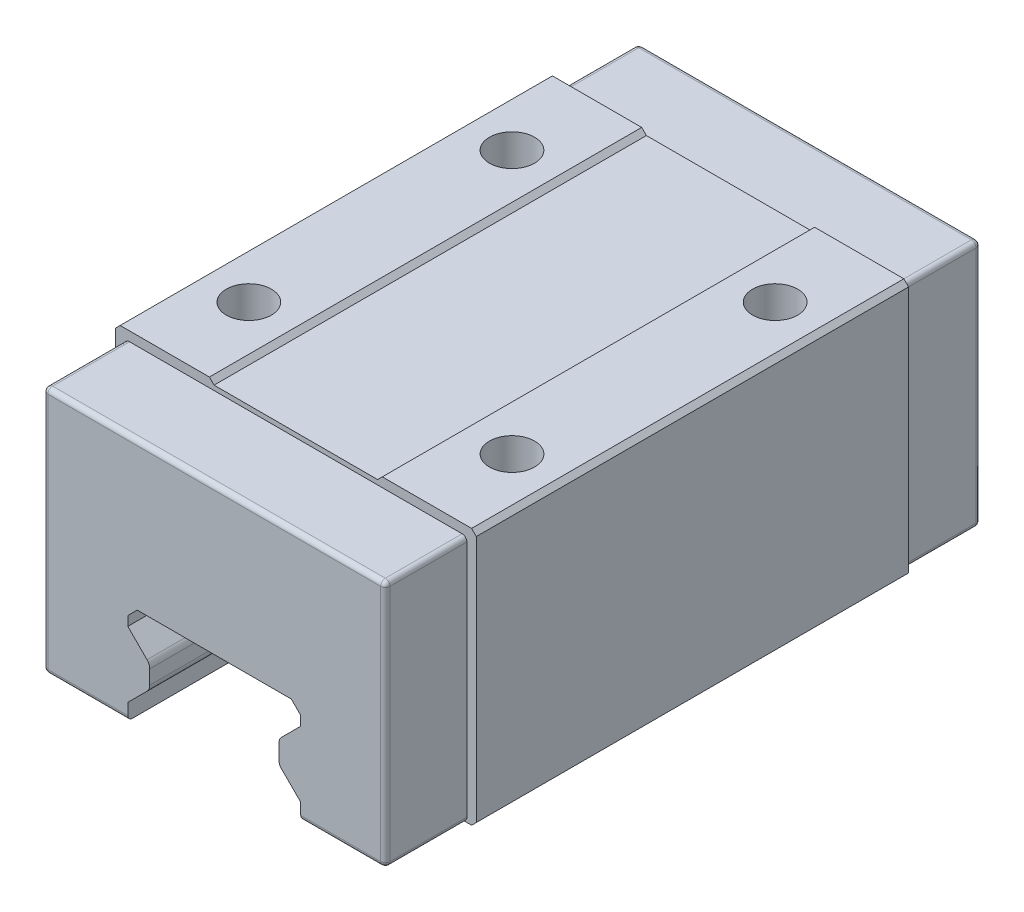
SolidWorks part; units mm, degrees
ref_plane "Front Plane" through (0, 0, 0) normal (0, 0, 1) x (1, 0, 0)
ref_plane "Top Plane" through (0, 0, 0) normal (0, 1, 0) x (1, 0, 0)
ref_plane "Right Plane" through (0, 0, 0) normal (1, 0, 0) x (0, 0, -1)
sketch "Sketch1" plane through (0, 0, 0) normal (0, 0, 1) x (1, 0, 0)
  line L1 (-24, 5.8) -> (24, 5.8)
  line L2 (-24, 5.8) -> (-24, 40)
  line L3 (-24, 40) -> (24, 40)
  line L4 (24, 5.8) -> (24, 40)
  line L5 (-24, 5.8) -> (24, 40) construction
  line L6 (-24, 40) -> (24, 5.8) construction
  point P0 (0, 22.9)
  dimension "D1" = 40
  dimension "D2" = 5.8
  dimension "D3" = 48
extrude "Boss-Extrude1" add sketch "Sketch1" along normal mid plane 57.5
sketch "Sketch2" plane through (0, 0, 0) normal (0, 0, 1) x (1, 0, 0)
  line L0 (-24, 5.8) -> (24, 5.8) construction
  line L1 (-22.75, 5.8) -> (22.75, 5.8)
  line L2 (-22.75, 5.8) -> (-22.75, 38.75)
  line L3 (-22.75, 38.75) -> (22.75, 38.75)
  line L4 (22.75, 5.8) -> (22.75, 38.75)
  line L5 (-22.75, 38.75) -> (-24, 38.75) construction
  line L6 (-24, 40) -> (-24, 5.8) construction
  line L7 (22.75, 38.75) -> (22.75, 40) construction
  line L8 (24, 40) -> (-24, 40) construction
  line L9 (22.75, 38.75) -> (24, 38.75) construction
  line L10 (24, 5.8) -> (24, 40) construction
  point P9 (0, 38.75)
  dimension "D1" = 1.25
extrude "Boss-Extrude2" add sketch "Sketch2" along normal mid plane 79.2
sketch "Sketch3" plane through (0, 0, 39.6) normal (0, 0, 1) x (1, 0, 0)
  line L1 (-11.5, 19.2) -> (11.5, 19.2)
  line L2 (-11.5, 19.2) -> (-11.5, 0)
  line L3 (-11.5, 0) -> (11.5, 0)
  line L4 (11.5, 19.2) -> (11.5, 0)
  line L5 (-11.5, 19.2) -> (11.5, 0) construction
  line L6 (-11.5, 0) -> (11.5, 19.2) construction
  point P0 (0, 9.6)
  dimension "D1" = 23
  dimension "D2" = 19.2
extrude "Cut-Extrude1" cut sketch "Sketch3" against normal through all
sketch "Sketch4" plane through (0, 0, 39.6) normal (0, 0, 1) x (1, 0, 0)
  line L0 (-11.5, 16.7) -> (-11.5, 7.95)
  line L1 (-11.5, 19.2) -> (-11.5, 5.8) construction
  line L2 (-11.5, 7.95) -> (-8.5833, 10.8667)
  line L3 (-8.5833, 10.8667) -> (-8.5833, 13.7833)
  line L4 (-8.5833, 13.7833) -> (-11.5, 16.7)
  line L5 (11.5, 19.2) -> (-11.5, 19.2) construction
  line L6 (-8.5833, 13.7833) -> (-11.5, 13.7833) construction
  line L7 (-8.5833, 10.8667) -> (-11.5, 10.8667) construction
  line L8 (-10.0417, 13.7833) -> (-10.0417, 10.8667) construction
  line L9 (0, 0) -> (0, 19.2) construction
  line L10 (10.0417, 13.7833) -> (10.0417, 10.8667) construction
  line L11 (8.5833, 10.8667) -> (11.5, 10.8667) construction
  line L12 (8.5833, 13.7833) -> (11.5, 13.7833) construction
  line L13 (8.5833, 13.7833) -> (11.5, 16.7)
  line L14 (8.5833, 10.8667) -> (8.5833, 13.7833)
  line L15 (11.5, 7.95) -> (8.5833, 10.8667)
  line L16 (11.5, 16.7) -> (11.5, 7.95)
extrude "Boss-Extrude3" add sketch "Sketch4" against normal up to surface (79.2 mm away)
chamfer "Chamfer1" distance 1.25 angle 45 2 edges at (11.5, 19.2, 0) (-11.5, 19.2, 0)
fillet "Fillet1" radius 1.25 4 edges at (8.5833, 10.8667, 0) (8.5833, 13.7833, 0) (-8.5833, 10.8667, 0) (-8.5833, 13.7833, 0)
sketch "Sketch5" plane through (0, 0, 28.75) normal (0, 0, 1) x (1, 0, 0)
  line L0 (24, 40) -> (-24, 40) construction
  line L1 (-11.5, 40) -> (11.5, 40)
  line L2 (-11.5, 40) -> (-11.5, 39.375)
  line L3 (-11.5, 39.375) -> (11.5, 39.375)
  line L4 (11.5, 40) -> (11.5, 39.375)
  point P6 (0, 39.375)
  dimension "D1" = 23
  dimension "D2" = 0.625
extrude "Cut-Extrude2" cut sketch "Sketch5" against normal through all
chamfer "Chamfer2" distance 0.625 angle 45 6 edges at (24, 40, 0) (24, 5.8, 0) (-24, 5.8, 0) (-24, 40, 0) (11.5, 39.375, 0) (-11.5, 39.375, 0)
fillet "Fillet2" radius 0.625 18 edges at (-22.75, 5.8, -34.175) (17.125, 5.8, -39.6) (-22.75, 5.8, 34.175) (-17.125, 5.8, -39.6) (-17.125, 5.8, 39.6) (17.125, 5.8, 39.6) (22.75, 5.8, 34.175) (-22.75, 22.275, 39.6) (-22.75, 22.275, -39.6) (-22.75, 38.75, 34.175) (22.75, 38.75, 34.175) (22.75, 22.275, 39.6) (22.75, 22.275, -39.6) (0, 38.75, 39.6) (0, 38.75, -39.6) (22.75, 5.8, -34.175) (22.75, 38.75, -34.175) (-22.75, 38.75, -34.175)
sketch "Sketch6" plane through (0, 40, 0) normal (0, 1, 0) x (1, 0, 0)
  line L0 (-17.5, 17.5) -> (0, 0) construction
  line L1 (0, 0) -> (17.5, -17.5) construction
  line L2 (17.5, 17.5) -> (0, 0) construction
  line L3 (0, 0) -> (-17.5, -17.5) construction
  circle A0 centre (-17.5, 17.5) radius 3
  circle A1 centre (-17.5, -17.5) radius 3
  circle A2 centre (17.5, -17.5) radius 3
  circle A3 centre (17.5, 17.5) radius 3
  dimension "D1" = 6
  dimension "D2" = 35
  dimension "D3" = 35
extrude "Cut-Extrude3" cut sketch "Sketch6" against normal blind 9
sketch "Sketch7" plane through (0, 0, 0) normal (0, 0, 1) x (1, 0, 0)
  line L0 (-23.375, 40) -> (-35, 40)
  line L1 (-35, 40) -> (-35, 30)
  line L2 (-23.375, 40) -> (-23.375, 19.625)
  line L3 (-24, 39.375) -> (-24, 6.425) construction
  line L4 (-24, 19.625) -> (-23.375, 19.625)
  line L5 (-35, 30) -> (-34.375, 30)
  line L6 (0, 0) -> (0, 39.375) construction
  line L7 (-10.875, 39.375) -> (10.875, 39.375) construction
  line L8 (35, 30) -> (34.375, 30)
  line L9 (24, 19.625) -> (23.375, 19.625)
  line L10 (23.375, 40) -> (23.375, 19.625)
  line L11 (35, 40) -> (35, 30)
  line L12 (23.375, 40) -> (35, 40)
  arc A1 (-34.375, 30) -> (-24, 19.625) centre (-34.375, 19.625) cw
  arc A2 (34.375, 30) -> (24, 19.625) centre (34.375, 19.625) ccw
  point P22 (-34.6875, 30)
  dimension "D1" = 70
  dimension "D2" = 10
  dimension "D3" = 0.625
extrude "Boss-Extrude4" [suppressed] add sketch "Sketch7" along normal mid plane 30
sketch "Sketch8" [suppressed] plane through (0, 0, 0) normal (0, 0, 1) x (1, 0, 0)
  line L5 (-35, 30) -> (-35, 40)
  line L6 (-35, 30) -> (-23.38, 30)
  line L7 (-35, 40) -> (-23.38, 40)
  line L8 (-23.38, 30) -> (-23.38, 40)
  line L9 (35, 30) -> (35, 40)
  line L10 (35, 30) -> (23.38, 30)
  line L11 (35, 40) -> (23.38, 40)
  line L13 (23.38, 40) -> (23.38, 30)
extrude "Boss-Extrude5" [suppressed] add sketch "Sketch8" along normal mid plane 57.5
chamfer "Chamfer3" [suppressed] distance 0.625 angle 45
fillet "Fillet3" [suppressed] radius 6
equation "\"D2@Sketch4\"=\"D1@Sketch4\"*3.5"
